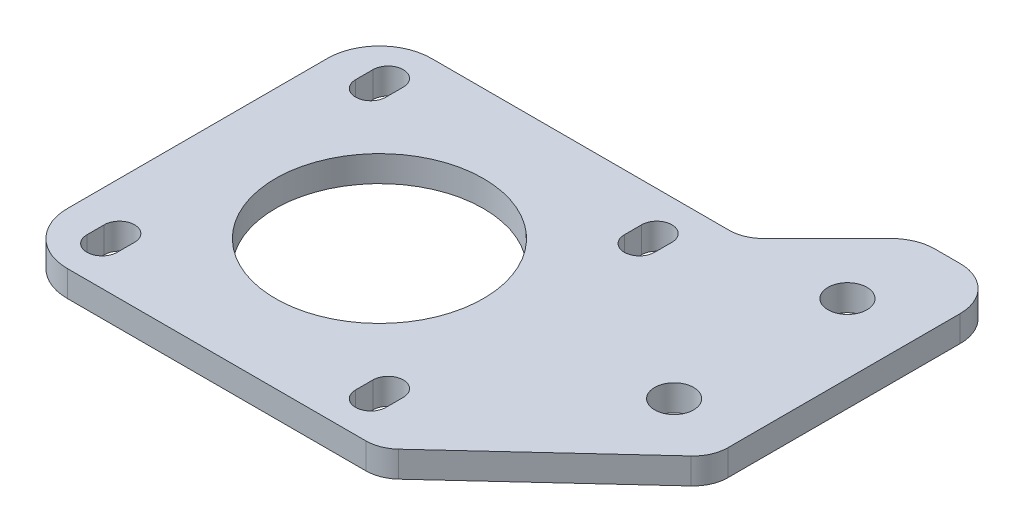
SolidWorks part; units mm, degrees
ref_plane "Top" through (0, 0, 0) normal (0, 0, 1) x (1, 0, 0)
ref_plane "Right" through (0, 0, 0) normal (0, 1, 0) x (1, 0, 0)
ref_plane "Front" through (0, 0, 0) normal (1, 0, 0) x (0, 0, -1)
sketch "Sketch2" plane through (0, 0, 0) normal (0, 1, 0) x (1, 0, 0)
  line L0 (17.25, -14.5) -> (17.25, -16.5)
  line L1 (13.75, -16.5) -> (13.75, -14.5)
  line L2 (-13.75, -14.5) -> (-13.75, -16.5)
  line L3 (-17.25, -16.5) -> (-17.25, -14.5)
  line L4 (13.75, 14.5) -> (13.75, 16.5)
  line L5 (17.25, 16.5) -> (17.25, 14.5)
  line L6 (-17.25, 14.5) -> (-17.25, 16.5)
  line L7 (-13.75, 16.5) -> (-13.75, 14.5)
  line L8 (-15, -21) -> (19.4368, -21)
  line L9 (22.149, -19.9401) -> (39.7122, -3.738)
  line L10 (41, -0.7979) -> (41, 26)
  line L11 (36, 31) -> (33.0711, 31)
  line L12 (29.5355, 29.5355) -> (22.1716, 22.1716)
  line L13 (19.3431, 21) -> (-15, 21)
  line L14 (-21, 15) -> (-21, -15)
  arc A0 (13.75, -14.5) -> (17.25, -14.5) centre (15.5, -14.5) cw
  arc A1 (17.25, -16.5) -> (13.75, -16.5) centre (15.5, -16.5) cw
  arc A2 (-13.75, -16.5) -> (-17.25, -16.5) centre (-15.5, -16.5) cw
  arc A3 (-17.25, -14.5) -> (-13.75, -14.5) centre (-15.5, -14.5) cw
  arc A4 (17.25, 14.5) -> (13.75, 14.5) centre (15.5, 14.5) cw
  arc A5 (13.75, 16.5) -> (17.25, 16.5) centre (15.5, 16.5) cw
  arc A6 (-13.75, 14.5) -> (-17.25, 14.5) centre (-15.5, 14.5) cw
  arc A7 (-17.25, 16.5) -> (-13.75, 16.5) centre (-15.5, 16.5) cw
  circle A8 centre (0, 0) radius 12
  circle A9 centre (33, 1) radius 2.25
  circle A10 centre (33, 21) radius 2.25
  arc A11 (-21, -15) -> (-15, -21) centre (-15, -15) ccw
  arc A12 (19.4368, -21) -> (22.149, -19.9401) centre (19.4368, -17) ccw
  arc A13 (39.7122, -3.738) -> (41, -0.7979) centre (37, -0.7979) ccw
  arc A14 (41, 26) -> (36, 31) centre (36, 26) ccw
  arc A15 (33.0711, 31) -> (29.5355, 29.5355) centre (33.0711, 26) ccw
  arc A16 (22.1716, 22.1716) -> (19.3431, 21) centre (19.3431, 25) cw
  arc A17 (-15, 21) -> (-21, 15) centre (-15, 15) ccw
  point P51 (17.25, 15.5)
  point P52 (17.25, -15.5)
  dimension "D1" = 6
  dimension "D2" = 1.75
  dimension "D3" = 24
  dimension "D5" = 4.5
  dimension "D6" = 20
  dimension "D7" = 31
  dimension "D10" = 5
  dimension "D11" = 5
  dimension "D4" = 42
  dimension "D8" = 31
  dimension "D9" = 21
  dimension "D12" = 10
  dimension "D13" = 20.2021
extrude "Boss-Extrude1" add sketch "Sketch2" along normal mid plane 3
